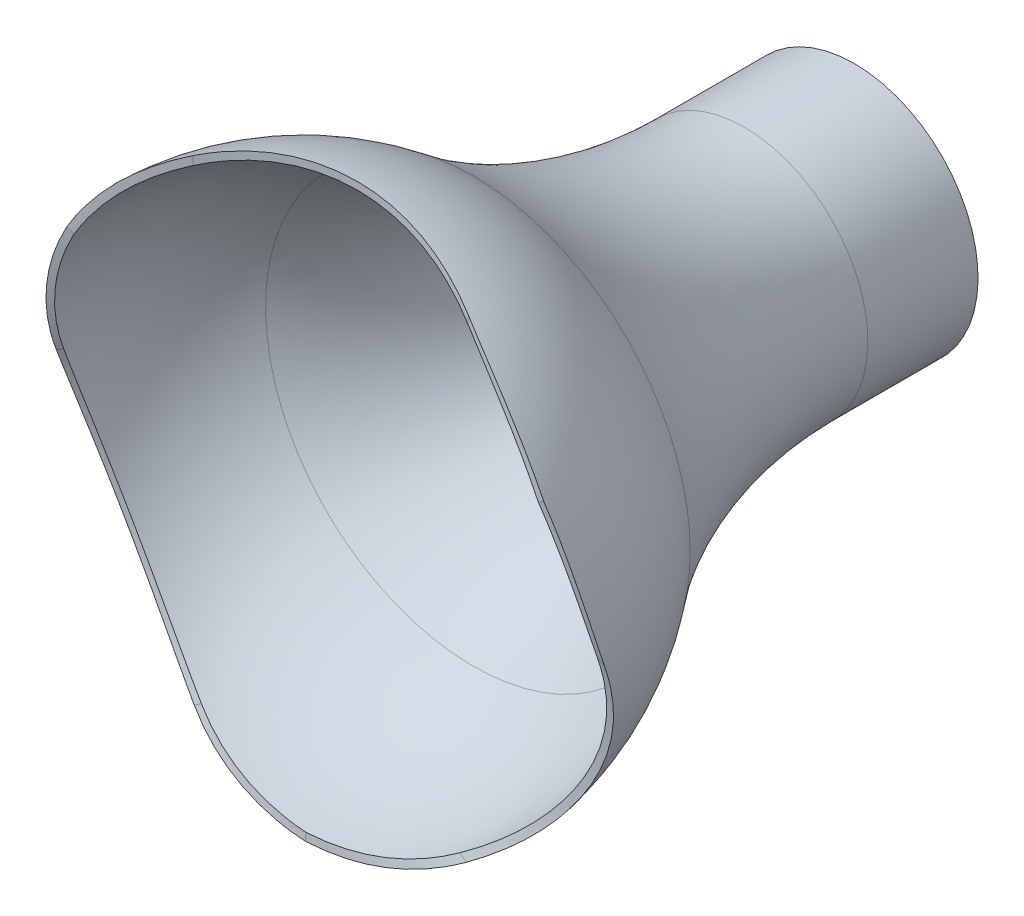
SolidWorks part; units mm, degrees
ref_plane "Piano frontale" through (0, 0, 0) normal (0, 0, 1) x (1, 0, 0)
ref_plane "Piano superiore" through (0, 0, 0) normal (0, 1, 0) x (1, 0, 0)
ref_plane "Piano destro" through (0, 0, 0) normal (1, 0, 0) x (0, 0, -1)
sketch "Schizzo1" plane through (0, 0, 0) normal (0, 0, 1) x (1, 0, 0)
  line L0 (0, 0) -> (0, 21) construction
  line L1 (19, 0) -> (19, 21)
  line L2 (19, 21) -> (20.2, 21)
  line L3 (20.2, 21) -> (20.2, 0)
  line L9 (19, 0) -> (20.2, 0)
  line L10 (45, 90) -> (69.8323, 90)
  line L11 (43.8, 90) -> (45, 90)
  line L12 (69.8323, 90) -> (69.8323, 0)
  line L13 (69.8323, 0) -> (20.2, 0)
  circle A0 centre (0, 90) radius 45 construction
  arc A1 (20.2, 18) -> (35.4547, 62.2878) centre (92.1161, 18) cw
  arc A2 (35.4547, 62.2878) -> (45, 90) centre (0, 90) ccw
  arc A3 (19, 21) -> (33.9187, 62.2878) centre (85.1365, 20.4419) cw
  arc A4 (33.9187, 62.2878) -> (43.8, 90) centre (0, 90) ccw
  dimension "D4" = 90
  dimension "D1" = 21
  dimension "D2" = 19
  dimension "D3" = 1.2
  dimension "D5" = 90
  dimension "D6" = 18
revolve "Rivoluzione1" add sketch "Schizzo1" angle 360 about L0
sketch "Schizzo4" plane through (0, 0, 0) normal (0, 0, 1) x (1, 0, 0)
  line L0 (43.8, 90) -> (-43.8, 90) construction
  line L1 (-45, 90) -> (45, 90)
  arc A0 (-45, 90) -> (-22.5, 85.6032) centre (-45, 30.2318) cw
  arc A1 (-22.5, 85.6032) -> (22.5, 85.6032) centre (0, 140.9746) ccw
  arc A2 (22.5, 85.6032) -> (45, 90) centre (45, 30.2318) cw
extrude "Taglio-Estrusione3" cut sketch "Schizzo4" against normal through all
pattern_circular "RipetizioneCircolare1" count 3 over 360 about axis through (0, 0, 0) along (0, -1, 0) of "Taglio-Estrusione3"
move or copy body "Corpo-Sposta/copia1"
